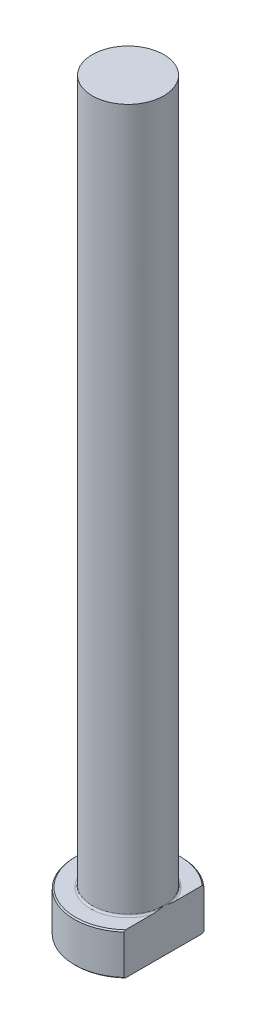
SolidWorks part; units mm, degrees
ref_plane "Front Plane" through (0, 0, 0) normal (0, 0, 1) x (1, 0, 0)
ref_plane "Top Plane" through (0, 0, 0) normal (0, 1, 0) x (1, 0, 0)
ref_plane "Right Plane" through (0, 0, 0) normal (1, 0, 0) x (0, 0, -1)
sketch "Sketch1" plane through (0, 0, 0) normal (0, 0, 1) x (1, 0, 0)
  line L0 (0, 259.9588) -> (0, -15.1925) construction
  line L1 (0, 0) -> (-9, 0)
  line L2 (-9, 0) -> (-9, 7)
  line L3 (-9, 7) -> (-6, 7)
  line L4 (-6, 7) -> (-6, 125)
  line L5 (-6, 125) -> (0, 125)
  line L6 (0, 125) -> (0, 0)
  dimension "L" = 125
  dimension "H" = 18
  dimension "T" = 7
  dimension "D" = 12
revolve "Revolve1" add sketch "Sketch1" angle 360 about L0
chamfer "Chamfer1" distance 0.2 angle 45 2 edges at (0, 7, 9) (0, 0, 9)
fillet "Fillet1" radius 0.3 1 edges at (0, 7, 6)
sketch "Sketch2" plane through (0, 0, 0) normal (0, 1, 0) x (1, 0, 0)
  line L0 (6, 6.7082) -> (6, -6.7082)
  circle A0 centre (0, 0) radius 9 construction
  arc A1 (6, -6.7082) -> (6, 6.7082) centre (0, 0) ccw
  circle A2 centre (0, 0) radius 6 construction
extrude "KEY" cut sketch "Sketch2" along normal through all
